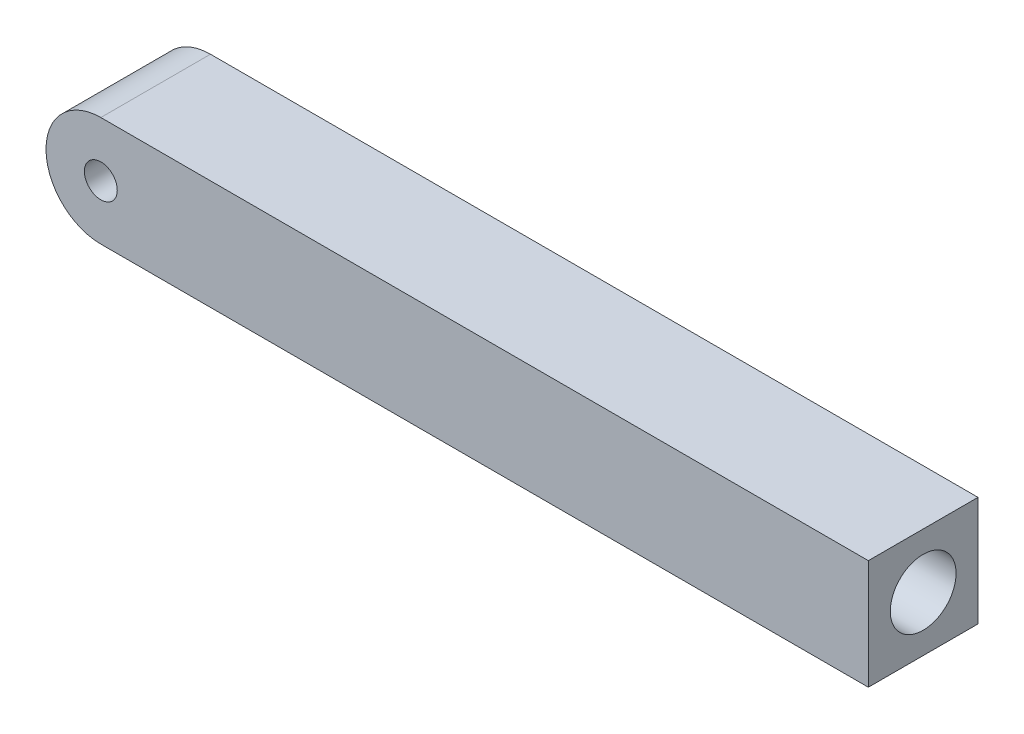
SolidWorks part; units mm, degrees
ref_plane "Plan1" through (0, 0, 0) normal (0, 0, 1) x (1, 0, 0)
ref_plane "Plan2" through (0, 0, 0) normal (0, 1, 0) x (1, 0, 0)
ref_plane "Plan3" through (0, 0, 0) normal (1, 0, 0) x (0, 0, -1)
sketch "Esquisse1" plane through (0, 0, 0) normal (0, 0, 1) x (1, 0, 0)
  line L0 (0, 2.5) -> (35, 2.5)
  line L1 (0, -2.5) -> (35, -2.5)
  line L2 (35, 2.5) -> (35, -2.5)
  arc A0 (0, 2.5) -> (0, -2.5) centre (0, 0) ccw
  circle A1 centre (0, 0) radius 0.75
  dimension "D1" = 5
  dimension "D3" = 1.5
  dimension "D2" = 35
extrude "Base-Extrusion" add sketch "Esquisse1" along normal blind 5
sketch "Esquisse2" plane through (35, 0, 0) normal (1, 0, 0) x (0, 0, -1)
  line L0 (-5, 0) -> (0, 0) construction
  line L2 (-5, -2.5) -> (-5, 2.5) construction
  circle A0 centre (-2.5, 0) radius 1.5
  dimension "D2" = 3
  dimension "D1" = 2.5
extrude "Enlèv. mat.-Extru.1" cut sketch "Esquisse2" against normal blind 20
